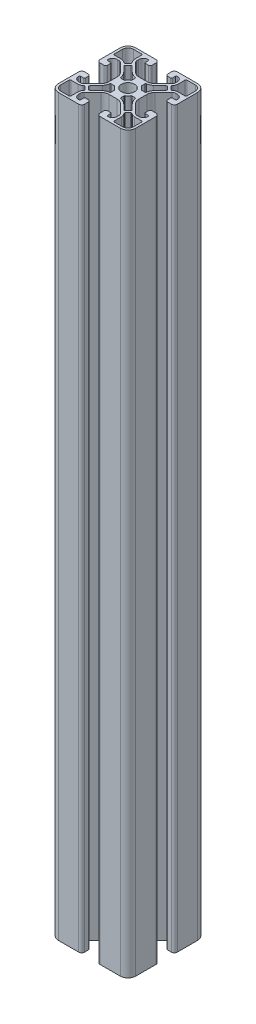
SolidWorks part; units mm, degrees
other "2018_07_20__14-51-15-564"
ref_plane "Ebene vorne" through (0, 0, 0) normal (0, 0, 1) x (1, 0, 0)
ref_plane "Ebene oben" through (0, 0, 0) normal (0, 1, 0) x (1, 0, 0)
ref_plane "Ebene rechts" through (0, 0, 0) normal (1, 0, 0) x (0, 0, -1)
imported_body "Importiert1"
sketch "Skizze1" plane through (0, 1500, 0) normal (0, 1, 0) x (1, 0, 0)
  line L1 (-21.9225, -25.1362) -> (21.9225, -25.1362)
  line L2 (-21.9225, -25.1362) -> (-21.9225, 25.1362)
  line L3 (-21.9225, 25.1362) -> (21.9225, 25.1362)
  line L4 (21.9225, -25.1362) -> (21.9225, 25.1362)
  line L5 (-21.9225, -25.1362) -> (21.9225, 25.1362) construction
  line L6 (-21.9225, 25.1362) -> (21.9225, -25.1362) construction
  point P0 (0, 0)
extrude "Schnitt-Linear austragen1" cut sketch "Skizze1" against normal offset from surface (2620 mm away) 380
